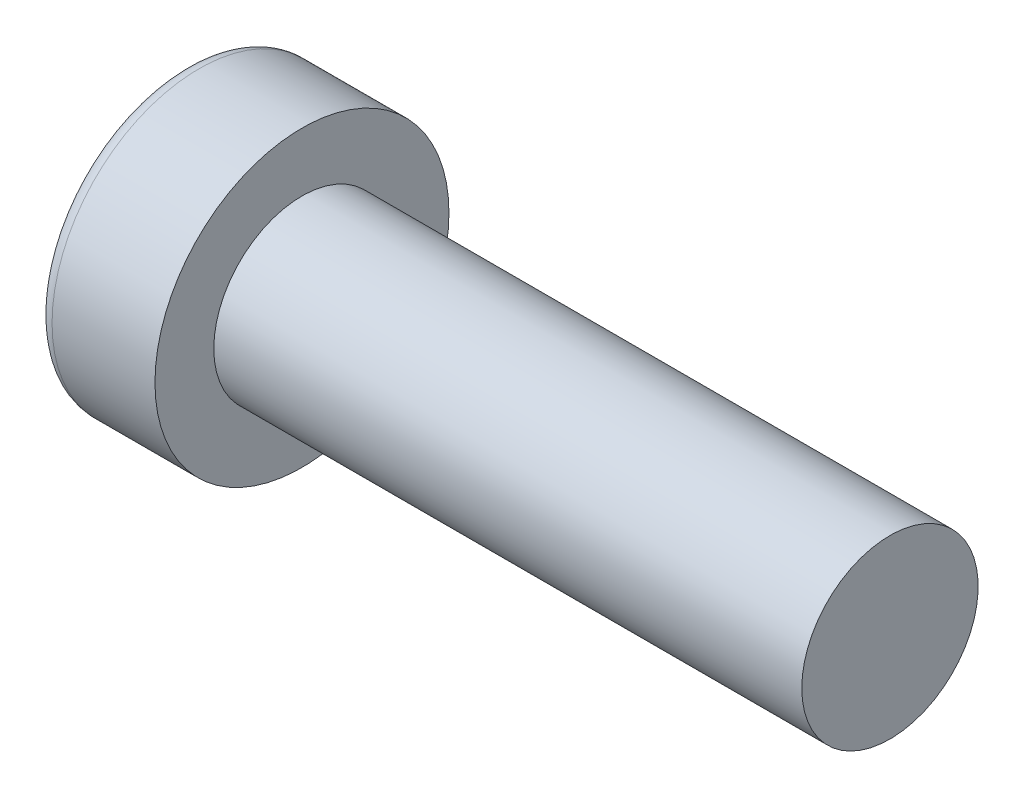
SolidWorks part; units mm, degrees
ref_plane "Ebene vorne" through (0, 0, 0) normal (0, 0, 1) x (1, 0, 0)
ref_plane "Ebene oben" through (0, 0, 0) normal (0, 1, 0) x (1, 0, 0)
ref_plane "Ebene rechts" through (0, 0, 0) normal (1, 0, 0) x (0, 0, -1)
sketch "Skizze1" plane through (0, 0, 0) normal (0, 0, 1) x (1, 0, 0)
  line L0 (-65.0118, 0) -> (64.6036, 0) construction
  line L1 (-24, 0) -> (-24, 5)
  line L2 (-24, 5) -> (-20, 5)
  line L3 (-20, 5) -> (-20, 3)
  line L4 (-20, 3) -> (0, 3)
  line L5 (0, 3) -> (0, 0)
  line L6 (0, 0) -> (-24, 0)
  dimension "D1" = 6
  dimension "D2" = 20
  dimension "D3" = 10
  dimension "D4" = 4
revolve "Rotation1" add sketch "Skizze1" angle 360 about L0
fillet "Verrundung1" radius 0.5
sketch "Skizze2" plane through (-24, 0, 0) normal (-1, 0, 0) x (0, 0, 1)
  line L1 (2, 1.1547) -> (0, 2.3094)
  line L2 (0, 2.3094) -> (-2, 1.1547)
  line L3 (-2, 1.1547) -> (-2, -1.1547)
  line L4 (-2, -1.1547) -> (0, -2.3094)
  line L5 (0, -2.3094) -> (2, -1.1547)
  line L6 (2, -1.1547) -> (2, 1.1547)
  circle A0 centre (0, 0) radius 2 construction
  dimension "D1" = 4
extrude "Schnitt-Linear austragen1" cut sketch "Skizze2" against normal blind 3
